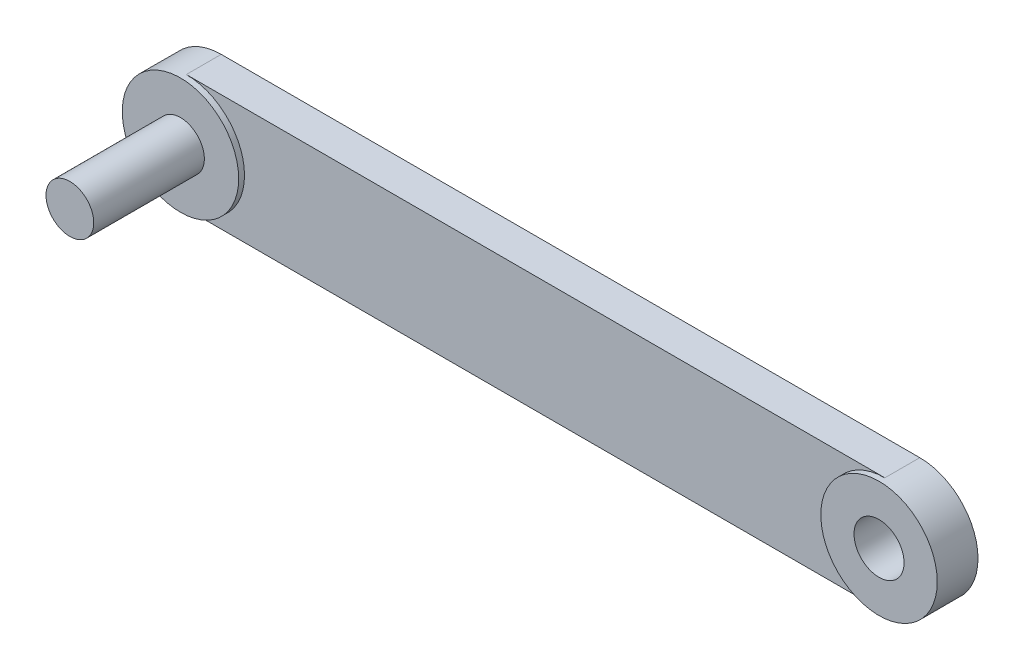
SolidWorks part; units mm, degrees
ref_plane "Plan de face" through (0, 0, 0) normal (0, 0, 1) x (1, 0, 0)
ref_plane "Plan de dessus" through (0, 0, 0) normal (0, 1, 0) x (1, 0, 0)
ref_plane "Plan de droite" through (0, 0, 0) normal (1, 0, 0) x (0, 0, -1)
sketch "Esquisse1" plane through (0, 0, 0) normal (0, 0, 1) x (1, 0, 0)
  line L0 (0, 0) -> (60, 0) construction
  line L1 (0, 5) -> (60, 5)
  line L2 (0, -5) -> (60, -5)
  arc A0 (0, 5) -> (0, -5) centre (0, 0) ccw
  arc A1 (60, -5) -> (60, 5) centre (60, 0) ccw
  circle A2 centre (0, 0) radius 2.05
  circle A3 centre (60, 0) radius 2.15
  point P3 (30, 0)
  dimension "D3" = 4.1
  dimension "D4" = 4.3
  dimension "D1" = 60
  dimension "D2" = 10
extrude "Boss.-Extru.1" add sketch "Esquisse1" along normal blind 3
sketch "Esquisse2" plane through (0, 0, 3) normal (0, 0, 1) x (1, 0, 0)
  line L0 (0, -5) -> (60, -5) construction
  circle A0 centre (0, 0) radius 5
  circle A1 centre (0, 0) radius 2.05
  circle A2 centre (60, 0) radius 2.15
  circle A3 centre (60, 0) radius 5
  circle A4 centre (60, 0) radius 2.15 construction
extrude "Boss.-Extru.2" add sketch "Esquisse2" along normal blind 0.5
sketch "Esquisse4" plane through (0, 0, 0) normal (0, 0, -1) x (-1, 0, 0)
  circle A0 centre (0, 0) radius 2.05 construction
  circle A1 centre (0, 0) radius 2.05
extrude "Boss.-Extru.3" add sketch "Esquisse4" against normal blind 13
